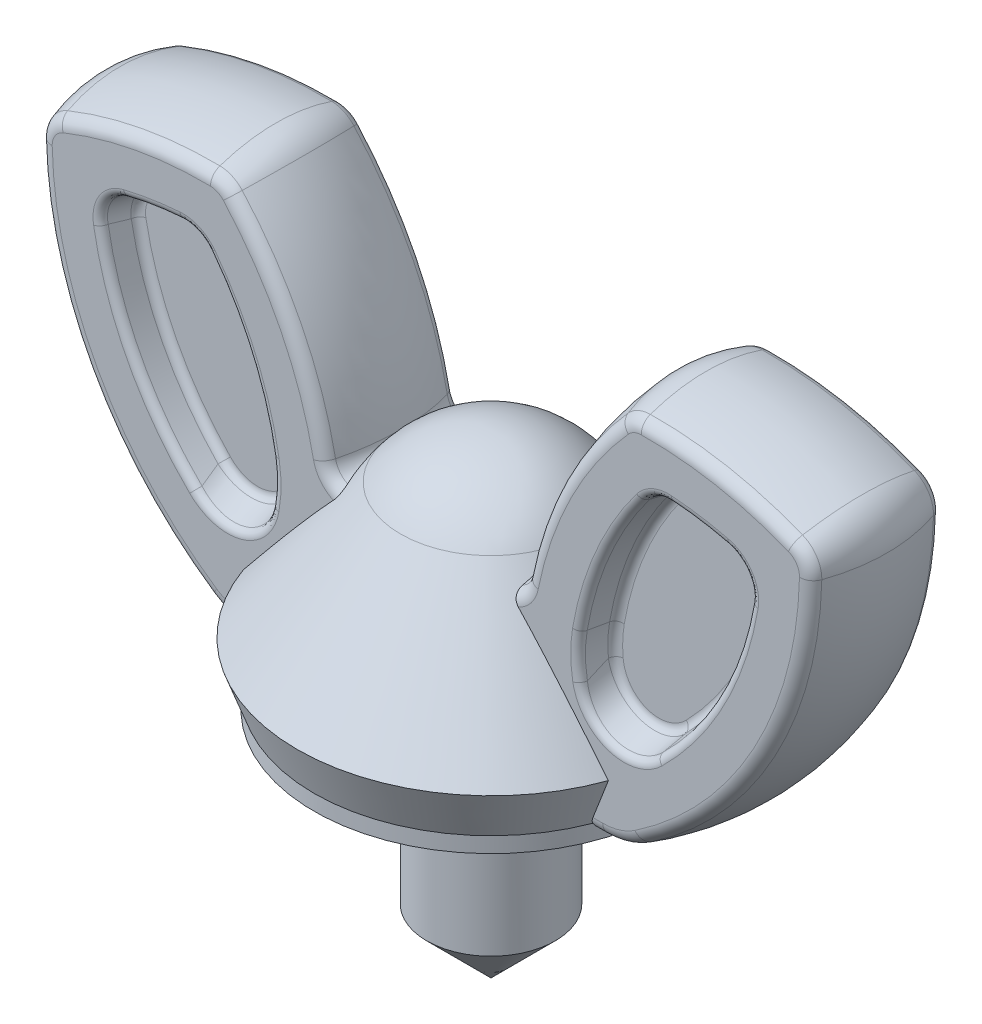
SolidWorks part; units mm, degrees
ref_plane "Front Plane" through (0, 0, 0) normal (0, 0, 1) x (1, 0, 0)
ref_plane "Top Plane" through (0, 0, 0) normal (0, 1, 0) x (1, 0, 0)
ref_plane "Right Plane" through (0, 0, 0) normal (1, 0, 0) x (0, 0, -1)
sketch "Sketch1" plane through (0, 0, 0) normal (0, 0, 1) x (1, 0, 0)
  line L0 (0, 10.7344) -> (0, 0) construction
  line L5 (4.826, 0) -> (-4.826, 0)
  line L6 (2.413, 5.08) -> (-2.413, 5.08)
  arc A11 (-2.413, 5.08) -> (-5.3975, 10.9034) centre (-13.1787, 3.2391) ccw
  arc A13 (-5.3975, 10.9034) -> (-10.795, 9.8298) centre (-6.0342, 0) ccw
  arc A24 (-10.795, 9.8298) -> (-6.0486, 0.3742) centre (0, 9.3295) ccw
  arc A26 (-4.826, 0) -> (-6.0486, 0.3742) centre (-4.826, 2.1844) cw
  arc A29 (4.826, 0) -> (6.0486, 0.3742) centre (4.826, 2.1844) ccw
  arc A34 (10.795, 9.8298) -> (6.0486, 0.3742) centre (0, 9.3295) cw
  arc A36 (5.3975, 10.9034) -> (10.795, 9.8298) centre (6.0342, 0) cw
  arc A37 (2.413, 5.08) -> (5.3975, 10.9034) centre (13.1787, 3.2391) cw
  point P19 (0, 0)
  point P27 (0, 5.08)
  point P29 (0, 5.08)
  point P44 (0, 5.08)
  dimension "D2" = 2.1844
  dimension "D1" = 5.3975
  dimension "D3" = 9.8298
  dimension "D4" = 10.922
  dimension "B" = 10.922
  dimension "A" = 21.59
  dimension "E" = 9.652
  dimension "G" = 5.08
  dimension "D5" = 4.826
extrude "Extrude1" add sketch "Sketch1" along normal mid plane 3.556
fillet "Fillet4" radius 1.0922 4 edges at (10.795, 9.8298, 0) (5.3975, 10.9034, 0) (-5.3975, 10.9034, 0) (-10.795, 9.8298, 0)
sketch "Sketch2" plane through (0, 0, 1.778) normal (0, 0, 1) x (1, 0, 0)
  line L0 (0, 0) -> (0, 12.8329) construction
  line L1 (-4.826, 0) -> (4.826, 0) construction
  arc A10 (-4.1864, 4.7767) -> (-5.0416, 1.8652) centre (-7.5893, 4.1949) cw
  arc A11 (4.1864, 4.7767) -> (6.2055, 9.1212) centre (13.1787, 3.2391) cw
  arc A12 (6.2055, 9.1212) -> (8.9805, 8.634) centre (6.0342, 0) cw
  arc A13 (8.9805, 8.634) -> (5.0416, 1.8652) centre (0, 9.3295) cw
  arc A14 (4.1864, 4.7767) -> (5.0416, 1.8652) centre (7.5893, 4.1949) ccw
  arc A15 (-8.9805, 8.634) -> (-5.0416, 1.8652) centre (0, 9.3295) ccw
  arc A16 (-6.2055, 9.1212) -> (-8.9805, 8.634) centre (-6.0342, 0) ccw
  arc A17 (-4.1864, 4.7767) -> (-6.2055, 9.1212) centre (-13.1787, 3.2391) ccw
  arc A18 (-8.9805, 8.634) -> (-5.0416, 1.8652) centre (0, 9.3295) ccw
  arc A19 (-6.2055, 9.1212) -> (-8.9805, 8.634) centre (-6.0342, 0) ccw
  arc A20 (-4.1864, 4.7767) -> (-6.2055, 9.1212) centre (-13.1787, 3.2391) ccw
  dimension "D1" = 1.7992
extrude "Cut-Extrude1" cut sketch "Sketch2" against normal blind 0.889 draft 10
fillet "Fillet1" radius 0.889 4 edges
fillet "Fillet6" radius 1.2446 2 edges
fillet "Fillet5" radius 0.3641 2 edges at (2.413, 5.08, 0) (-2.413, 5.08, 0)
fillet "Fillet3" radius 0.2223 28 edges at (7.4585, 9.011, 1.778) (7.4007, 8.8613, 0.889) (6.4621, 8.9114, 0.889) (8.6146, 8.3041, 0.889) (7.8855, 5.3103, 0.889) (4.2988, 4.3764, 0.889) (6.1282, 8.9579, 1.778) (8.7221, 8.5339, 1.778) (7.9776, 5.1471, 1.778) (4.1377, 4.1292, 1.778) (-4.2988, 4.3764, 0.889) (-7.8855, 5.3103, 0.889) (-8.5332, 8.4279, 0.889) (-7.4007, 8.8613, 0.889) (-6.1942, 8.7899, 0.889) (-4.1377, 4.1292, 1.778) (-7.9776, 5.1471, 1.778) (-8.7866, 8.4358, 1.778) (-7.4585, 9.011, 1.778) (-6.3795, 9.0717, 1.778) (4.9351, 6.7652, 0.889) (4.81, 6.8709, 1.778) (-4.9351, 6.7652, 0.889) (-4.81, 6.8709, 1.778) (4.9742, 2.938, 0.889) (5.0791, 2.5366, 1.778) (-5.2102, 2.8514, 0.889) (-5.0131, 2.5568, 1.778)
mirror "Mirror1" about plane through (0, 0, 0) normal (0, 0, 1) of "Fillet6", "Fillet3", "Fillet1", "Cut-Extrude1"
sketch "Sketch4" plane through (0, 0, 0) normal (1, 0, 0) x (0, 0, -1)
  line L1 (-1.778, 5.334) -> (1.778, 5.334)
  line L2 (-1.778, 4.4704) -> (-1.778, 5.334)
  line L4 (1.778, 0.3742) -> (1.778, 9.0918) construction
  line L6 (-1.778, 9.0918) -> (-1.778, 0.3742) construction
  line L7 (0, 5.715) -> (0, 0.381) construction
  line L9 (1.778, 4.4704) -> (1.778, 5.334)
  line L10 (-1.778, 5.08) -> (1.778, 5.08) construction
  arc A0 (-1.524, 4.826) -> (-1.778, 4.4704) centre (-1.4021, 4.4704) ccw
  arc A1 (1.524, 4.826) -> (-1.524, 4.826) centre (0, 0.381) ccw
  arc A2 (1.524, 4.826) -> (1.778, 4.4704) centre (1.4021, 4.4704) cw
  point P8 (0, 5.08)
  dimension "D1" = 0.254
  dimension "D2" = 0.254
  dimension "D3" = 0.254
sketch3d "3DSketch1"
  line L2 (-2.1102, 5.08, 1.778) -> (2.1102, 5.08, 1.778)
  line L3 (4.826, 0, 1.778) -> (-4.826, 0, 1.778)
  line L4 (-2.1102, 5.08, 1.778) -> (2.1102, 5.08, 1.778)
  line L5 (4.826, 0, 1.778) -> (-4.826, 0, 1.778)
  arc A15 (10.804, 9.0918, 1.778) -> (6.0486, 0.3742, 1.778) centre (0, 9.3295, 1.778) ccw
  arc A16 (10.1207, 10.1287, 1.778) -> (10.804, 9.0918, 1.778) centre (9.712, 9.1158, 1.778) ccw
  arc A17 (5.8682, 10.9207, 1.778) -> (10.1207, 10.1287, 1.778) centre (6.0342, 0, 1.778) ccw
  arc A18 (5.0743, 10.5608, 1.778) -> (5.8682, 10.9207, 1.778) centre (5.8848, 9.8287, 1.778) ccw
  arc A19 (2.4672, 5.3729, 1.778) -> (5.0743, 10.5608, 1.778) centre (13.1787, 3.2391, 1.778) ccw
  arc A20 (2.1102, 5.08, 1.778) -> (2.4672, 5.3729, 1.778) centre (2.1102, 5.4441, 1.778) ccw
  arc A21 (2.1102, 5.08, 1.778) -> (2.4672, 5.3729, 1.778) centre (2.1102, 5.4441, 1.778) ccw
  arc A22 (-5.0743, 10.5608, 1.778) -> (-2.4672, 5.3729, 1.778) centre (-13.1787, 3.2391, 1.778) ccw
  arc A23 (-5.8682, 10.9207, 1.778) -> (-5.0743, 10.5608, 1.778) centre (-5.8848, 9.8287, 1.778) ccw
  arc A24 (-10.1207, 10.1287, 1.778) -> (-5.8682, 10.9207, 1.778) centre (-6.0342, 0, 1.778) ccw
  arc A25 (-10.804, 9.0918, 1.778) -> (-10.1207, 10.1287, 1.778) centre (-9.712, 9.1158, 1.778) ccw
  arc A26 (-6.0486, 0.3742, 1.778) -> (-10.804, 9.0918, 1.778) centre (0, 9.3295, 1.778) ccw
  arc A27 (-4.826, 0, 1.778) -> (-6.0486, 0.3742, 1.778) centre (-4.826, 2.1844, 1.778) ccw
  arc A28 (6.0486, 0.3742, 1.778) -> (4.826, 0, 1.778) centre (4.826, 2.1844, 1.778) ccw
  arc A29 (10.804, 9.0918, 1.778) -> (6.0486, 0.3742, 1.778) centre (0, 9.3295, 1.778) ccw
  arc A30 (10.1207, 10.1287, 1.778) -> (10.804, 9.0918, 1.778) centre (9.712, 9.1158, 1.778) ccw
  arc A31 (5.8682, 10.9207, 1.778) -> (10.1207, 10.1287, 1.778) centre (6.0342, 0, 1.778) ccw
  arc A32 (5.0743, 10.5608, 1.778) -> (5.8682, 10.9207, 1.778) centre (5.8848, 9.8287, 1.778) ccw
  arc A33 (2.4672, 5.3729, 1.778) -> (5.0743, 10.5608, 1.778) centre (13.1787, 3.2391, 1.778) ccw
  arc A34 (-2.4672, 5.3729, 1.778) -> (-2.1102, 5.08, 1.778) centre (-2.1102, 5.4441, 1.778) ccw
  arc A35 (-2.4672, 5.3729, 1.778) -> (-2.1102, 5.08, 1.778) centre (-2.1102, 5.4441, 1.778) ccw
  arc A36 (-5.0743, 10.5608, 1.778) -> (-2.4672, 5.3729, 1.778) centre (-13.1787, 3.2391, 1.778) ccw
  arc A37 (-5.8682, 10.9207, 1.778) -> (-5.0743, 10.5608, 1.778) centre (-5.8848, 9.8287, 1.778) ccw
  arc A38 (-10.1207, 10.1287, 1.778) -> (-5.8682, 10.9207, 1.778) centre (-6.0342, 0, 1.778) ccw
  arc A39 (-10.804, 9.0918, 1.778) -> (-10.1207, 10.1287, 1.778) centre (-9.712, 9.1158, 1.778) ccw
  arc A40 (-6.0486, 0.3742, 1.778) -> (-10.804, 9.0918, 1.778) centre (0, 9.3295, 1.778) ccw
  arc A41 (-4.826, 0, 1.778) -> (-6.0486, 0.3742, 1.778) centre (-4.826, 2.1844, 1.778) ccw
  arc A42 (6.0486, 0.3742, 1.778) -> (4.826, 0, 1.778) centre (4.826, 2.1844, 1.778) ccw
  point P3 (2.1102, 5.4441, 2.1421)
  point P5 (2.1102, 5.4441, 2.1421)
  point P11 (-2.1102, 5.4441, 2.1421)
  point P13 (-2.1102, 5.4441, 2.1421)
  point P43 (0, 9.3295, -9.0286)
  point P46 (9.712, 9.1158, 0.6858)
  point P48 (6.0342, 0, -9.144)
  point P50 (5.8848, 9.8287, 0.6858)
  point P52 (13.1787, 3.2391, -9.144)
  point P58 (-13.1787, 3.2391, -9.144)
  point P60 (-5.8848, 9.8287, 0.6858)
  point P62 (-6.0342, 0, -9.144)
  point P64 (-9.712, 9.1158, 0.6858)
  point P66 (0, 9.3295, -9.0286)
  point P68 (-4.826, 2.1844, -0.4064)
  point P70 (4.826, 2.1844, -0.4064)
  point P71 (0, 9.3295, -9.0286)
  point P72 (9.712, 9.1158, 0.6858)
  point P73 (6.0342, 0, -9.144)
  point P74 (5.8848, 9.8287, 0.6858)
  point P75 (13.1787, 3.2391, -9.144)
  point P78 (-13.1787, 3.2391, -9.144)
  point P79 (-5.8848, 9.8287, 0.6858)
  point P80 (-6.0342, 0, -9.144)
  point P81 (-9.712, 9.1158, 0.6858)
  point P82 (0, 9.3295, -9.0286)
  point P83 (-4.826, 2.1844, -0.4064)
  point P84 (4.826, 2.1844, -0.4064)
  dimension "D1" = 0
sweep "Cut-Sweep2" cut profiles "Sketch4" path "3DSketch1"
sketch "Sketch3" plane through (0, 0, 0) normal (0, 0, 1) x (1, 0, 0)
  line L0 (0, 6.5903) -> (0, -11.3525) construction
  line L1 (1.7526, 0) -> (4.826, 0)
  line L2 (5.2882, 1.6933) -> (2.4672, 5.3729)
  line L4 (1.7526, 0) -> (1.7526, -6.35)
  line L5 (1.7526, -6.35) -> (0, -6.35)
  line L6 (4.826, 0) -> (4.826, 0.4233)
  line L7 (0, 6.5903) -> (0, -6.35)
  line L8 (0, 6.5903) -> (-2.4754, 6.5903) construction
  line L9 (4.826, 0.4233) -> (5.2882, 1.6933)
  arc A1 (2.4672, 5.3729) -> (0, 6.5903) centre (0, 3.4814) ccw
  dimension "D2" = 1.27
  dimension "D3" = 9.652
  dimension "d1" = 3.5052
  dimension "D4" = 0.4233
  dimension "L" = 6.35
  dimension "D5" = 20
revolve "Revolve1" add sketch "Sketch3" angle 360 about L0
sketch "Sketch6" plane through (0, 0, 0) normal (0, 0, 1) x (1, 0, 0)
  line L0 (0, 4.5862) -> (0, -8.2597) construction
  line L1 (0, -6.35) -> (2.0066, -4.3434)
  line L2 (-1.7526, -6.35) -> (1.7526, -6.35) construction
  line L3 (2.0066, -4.3434) -> (2.0066, -6.604)
  line L4 (2.0066, -6.604) -> (0, -6.604)
  line L5 (0, -6.604) -> (0, -6.35)
  line L8 (1.7526, -6.35) -> (1.7526, 0) construction
  dimension "D1" = 135
  dimension "D2" = 0.254
  dimension "D3" = 0.254
revolve "Cut-Revolve11" cut sketch "Sketch6" angle 360 about L0
sketch "Sketch5" plane through (0, 0, 0) normal (0, 0, 1) x (1, 0, 0)
  line L0 (1.7526, -0.0254) -> (1.2802, -0.2982)
  line L1 (1.2802, -0.2982) -> (1.7526, -0.5709)
  line L2 (1.7526, -0.5709) -> (1.7526, -0.0254)
  line L3 (0, 0) -> (0, -7.7715) construction
  line L6 (1.2802, -0.2982) -> (1.2802, -1.0906) construction
  dimension "D1" = 3.5052
  dimension "D2" = 2.5603
  dimension "D3" = 0.0254
  dimension "pitch" = 0.7925
revolve "Cut-Revolve10" [suppressed] cut sketch "Sketch5" angle 360 about L3
pattern_linear "LPattern10" [suppressed] count 8 spacing 0.7925 along (0, -1, 0)
equation "\"D5@Sketch1\" = \"E@Sketch1\" / 2"
equation "\"D1@Sketch1\" = \"A@Sketch1\" / 4"
equation "\"D3@Sketch1\" = \"B@Sketch1\" * 9 /  10"
equation "\"D4@Sketch1\" = \"B@Sketch1\""
equation "\"D2@Sketch1\" = \"D4@Sketch1\" / 5"
equation "\"D1@Cut-Extrude1\" = \"C@Extrude1\" / 4"
equation "\"D1@Fillet1\" = \"D1@Cut-Extrude1\""
equation "\"D1@Fillet3\" = \"D1@Cut-Extrude1\" / 4"
equation "\"D2@Sketch3\" = \"G@Sketch1\" / 4"
equation "\"D3@Sketch3\" = \"E@Sketch1\""
equation "\"D1@Sketch4\" = \"C@Extrude1\" / 14"
equation "\"D1@Sketch5\" = \"d1@Sketch3\""
equation "\"D2@Sketch5\" = \"THD_MINOR@Cosmetic Thread1\""
equation "\"D3@LPattern10\" = \"pitch@Sketch5\""
equation "\"D1@LPattern10\" = \"L@Sketch3\" / \"D3@LPattern10\""
equation "\"D1@Cosmetic Thread1\" = \"L@Sketch3\""
equation "\"D2@Sketch4\" = \"D1@Sketch4\""
equation "\"D4@Sketch3\" = \"D2@Sketch3\" / 3"
equation "\"D1@Fillet4\" = \"D2@Sketch1\" /2"
equation "\"D1@Sketch2\" = \"D1@Sketch1\" / 3"
equation "\"D1@Fillet5\" = \"D1@Fillet4\" / 3"
equation "\"D1@Fillet6\" = \"D1@Fillet1\" * 1.4"
